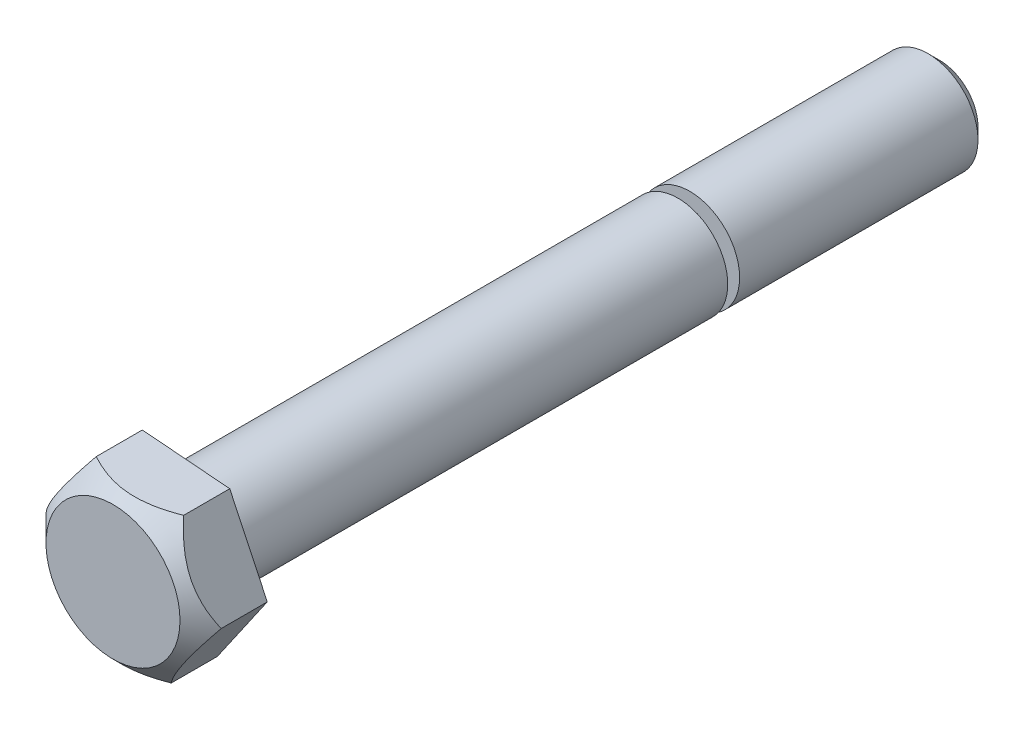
SolidWorks part; units mm, degrees
ref_plane "Front Plane" through (0, 0, 0) normal (0, 0, 1) x (1, 0, 0)
ref_plane "Top Plane" through (0, 0, 0) normal (0, 1, 0) x (1, 0, 0)
ref_plane "Right Plane" through (0, 0, 0) normal (1, 0, 0) x (0, 0, -1)
sketch "Sketch2" plane through (0, 0, 0) normal (0, 0, 1) x (1, 0, 0)
  circle A0 centre (0, 0) radius 2.0828
  dimension "D1" = 4.1656
extrude "Boss-Extrude1" add sketch "Sketch2" along normal blind 31.75
sketch "Sketch3" plane through (0, 0, 31.75) normal (0, 0, 1) x (1, 0, 0)
  line L1 (3.654, -0.2984) -> (2.0854, 3.0153)
  line L2 (2.0854, 3.0153) -> (-1.5686, 3.3137)
  line L3 (-1.5686, 3.3137) -> (-3.654, 0.2984)
  line L4 (-3.654, 0.2984) -> (-2.0854, -3.0153)
  line L5 (-2.0854, -3.0153) -> (1.5686, -3.3137)
  line L6 (1.5686, -3.3137) -> (3.654, -0.2984)
  circle A0 centre (0, 0) radius 3.175 construction
  dimension "D1" = 6.35
extrude "Boss-Extrude2" add sketch "Sketch3" along normal blind 2.794
sketch "Sketch4" plane through (0, 0, 0) normal (0, 1, 0) x (1, 0, 0)
  line L0 (0, -104.2227) -> (0, -111.5377) construction
sketch "Sketch5" plane through (0, 0, 0) normal (0, 1, 0) x (1, 0, 0)
  line L1 (3.3933, -10.4386) -> (1.2105, -10.4386)
  line L2 (3.3933, -10.4386) -> (3.3933, -10.9335)
  line L3 (0, 0) -> (0, -126.4676) construction
  line L4 (0.3209, -37.0237) -> (5.3758, -31.9688)
  line L5 (0.3209, -37.0237) -> (5.3758, -37.0237)
  line L6 (5.3758, -37.0237) -> (5.3758, -31.9688)
  line L7 (3.3933, -10.9335) -> (1.2105, -10.9335)
  line L8 (1.2105, -10.4386) -> (1.2105, -10.9335)
revolve "Cut-Revolve1" cut sketch "Sketch5" angle 360 about L3
sketch "Sketch6" plane through (0, 0, 0) normal (1, 0, 0) x (0, 0, -1)
  line L0 (0, 0) -> (5.9681, 0) construction
  line L1 (-48.8317, 3.4111) -> (-49.2965, 3.4111)
  line L2 (-48.8317, 3.4111) -> (-48.8317, 1.2735)
  line L3 (-48.8317, 1.2735) -> (-49.2965, 1.2735)
  line L4 (-49.2965, 3.4111) -> (-49.2965, 1.2735)
  line L5 (-1.8037, 3.4111) -> (1.4398, 0.1676)
  line L6 (1.4398, 0.1676) -> (1.4398, 3.4111)
  line L7 (-1.8037, 3.4111) -> (1.4398, 3.4111)
  dimension "D1" = 45
revolve "Cut-Revolve2" cut sketch "Sketch6" angle 360 about L0
